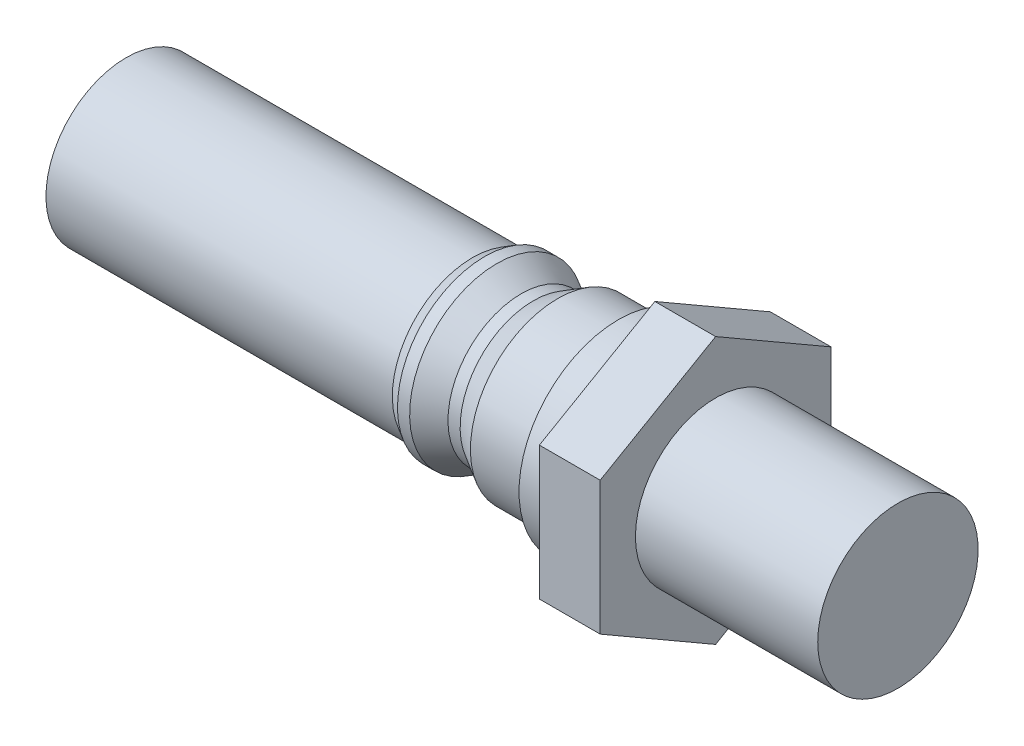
SolidWorks part; units mm, degrees
ref_plane "Alzado" through (0, 0, 0) normal (0, 0, 1) x (1, 0, 0)
ref_plane "Planta" through (0, 0, 0) normal (0, 1, 0) x (1, 0, 0)
ref_plane "Vista lateral" through (0, 0, 0) normal (1, 0, 0) x (0, 0, -1)
sketch "Croquis1" plane through (0, 0, 0) normal (0, 0, 1) x (1, 0, 0)
  line L0 (0, 0) -> (43.5, 0) construction
  line L1 (0, 0) -> (0, 6.6)
  line L2 (0, 6.6) -> (28.5, 6.6)
  line L3 (28.5, 6.6) -> (29.5, 7.1774)
  line L4 (29.5, 7.1774) -> (30.5, 7.1774)
  line L5 (30, 7.1774) -> (30, 0) construction
  line L6 (31.5, 6.6) -> (30.5, 7.1774)
  line L7 (31.5, 6.6) -> (32.5, 6.0226)
  line L8 (32.5, 6.0226) -> (33.5, 6.0226)
  line L9 (33, 6.0226) -> (33, 0) construction
  line L10 (34.5, 6.6) -> (33.5, 6.0226)
  line L11 (34.5, 6.6) -> (35.5, 7.1774)
  line L12 (35.5, 7.1774) -> (40.5, 7.1774)
  line L14 (43.5, 0) -> (0, 0)
  line L15 (40.5, 7.1774) -> (40.5, 8.1774)
  line L16 (40.5, 8.1774) -> (43.5, 8.1774)
  line L17 (43.5, 8.1774) -> (43.5, 0)
  point P18 (27.5743, 0)
  dimension "D1" = 13.2
  dimension "D2" = 28.5
  dimension "D3" = 1
  dimension "D4" = 1
  dimension "D5" = 150
  dimension "D6" = 1
  dimension "D7" = 1
  dimension "D8" = 5
  dimension "D9" = 1
  dimension "D10" = 3
revolve "Revolución1" add sketch "Croquis1" angle 360 about L14
sketch "Croquis8" plane through (43.5, 0, 0) normal (1, 0, 0) x (0, 0, -1)
  line L1 (0, 10.9697) -> (-9.5, 5.4848)
  line L2 (-9.5, 5.4848) -> (-9.5, -5.4848)
  line L3 (-9.5, -5.4848) -> (0, -10.9697)
  line L4 (0, -10.9697) -> (9.5, -5.4848)
  line L5 (9.5, -5.4848) -> (9.5, 5.4848)
  line L6 (9.5, 5.4848) -> (0, 10.9697)
  circle A0 centre (0, 0) radius 9.5 construction
  dimension "D1" = 19
extrude "Saliente-Extruir6" add sketch "Croquis8" along normal blind 5
sketch "Croquis11" plane through (0, 0, 0) normal (0, 0, 1) x (1, 0, 0)
  line L0 (48.5, 0) -> (52.1801, 0) construction
  line L1 (48.5, 5.4848) -> (48.5, -5.4848) construction
  line L2 (48.5, 0) -> (48.5, 6.6)
  line L3 (48.5, 6.6) -> (63.5, 6.6)
  line L4 (63.5, 6.6) -> (63.5, 0)
  line L5 (63.5, 0) -> (48.5, 0)
  dimension "D1" = 13.2
  dimension "D2" = 15
revolve "Revolución4" add sketch "Croquis11" angle 360 about L0
